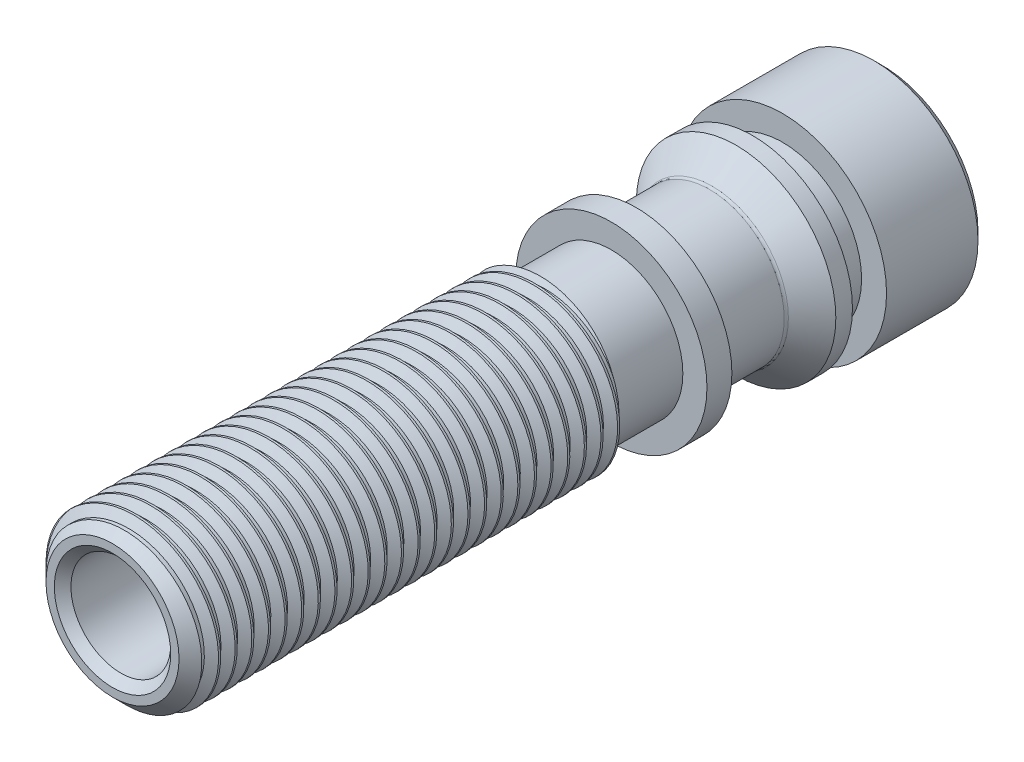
SolidWorks part; units mm, degrees
ref_plane "Front" through (0, 0, 0) normal (0, 0, 1) x (1, 0, 0)
ref_plane "Top" through (0, 0, 0) normal (0, 1, 0) x (1, 0, 0)
ref_plane "Right" through (0, 0, 0) normal (1, 0, 0) x (0, 0, -1)
sketch "Esquisse1" plane through (0, 0, 0) normal (0, 0, 1) x (1, 0, 0)
  circle A0 centre (0, 0) radius 5.75
  dimension "D1" = 11.5
extrude "Boss.-Extru.1" add sketch "Esquisse1" along normal blind 1.5
sketch "Esquisse2" plane through (0, 0, 1.5) normal (0, 0, 1) x (1, 0, 0)
  circle A0 centre (0, 0) radius 4.3
  dimension "D1" = 8.6
extrude "Boss.-Extru.2" add sketch "Esquisse2" along normal blind 4
sketch "Esquisse3" plane through (0, 0, 5.5) normal (0, 0, 1) x (1, 0, 0)
  circle A0 centre (0, 0) radius 5
  dimension "D1" = 10
extrude "Boss.-Extru.3" add sketch "Esquisse3" along normal blind 26
chamfer "Chanfrein1" distance 1 angle 45 1 edges at (5, 0, 31.5)
sketch "Esquisse4" plane through (0, 0, 31.5) normal (0, 0, 1) x (1, 0, 0)
  circle A0 centre (0, 0) radius 3
  dimension "D1" = 6
extrude "Enlèv. mat.-Extru.1" cut sketch "Esquisse4" against normal through all
thread "Filetage1" pitch 1 start angle 0, offset 2, length 0, pitch 1, diameter 10
ref_plane "Plan1" through (-5, 0, 32.5) normal (0, -1, 0) x (-1, 0, 0)
sketch "Profil de filetage1" plane through (-5, 0, 32.5) normal (0, -1, 0) x (-1, 0, 0)
  line L0 (0, 0) -> (0, 1) construction
  line L11 (0, 0) -> (0, 0.875)
  line L12 (0, 0.875) -> (-0.5413, 0.5625)
  line L13 (-0.5413, 0.5625) -> (-0.5413, 0.3125)
  line L15 (-0.5413, 0.3125) -> (0, 0)
  line L17 (-0.5413, 0.4375) -> (0, 0.4375) construction
  point P2 (0, 0)
  dimension "Pitch" = 1
  dimension "Profile_Angle" = 60
  dimension "Profile_Land" = 0.25
  dimension "Profile_Height" = 0.5413
sketch "Esquisse6" plane through (0, 0, 0) normal (1, 0, 0) x (0, 0, -1)
  line L0 (0, 0) -> (23.0549, 0) construction
  line L1 (0, 4.5) -> (4.5, 4.5)
  line L2 (0, -5.75) -> (0, 5.75) construction
  line L3 (12.8, 4.5) -> (12.8, 3)
  line L4 (4.5, 4.5) -> (6, 6)
  line L5 (6, 6) -> (7, 6)
  line L6 (7, 6) -> (7, 4.75)
  line L7 (7, 4.75) -> (8.8, 4.75)
  line L8 (8.8, 4.75) -> (8.8, 6.25)
  line L9 (8.8, 6.25) -> (14.8, 6.25)
  line L10 (14.8, 6.25) -> (14.8, 3)
  line L11 (14.8, 3) -> (12.8, 3)
  line L12 (12.8, 4.5) -> (10.35, 4.5)
  line L13 (10.35, 4.5) -> (10.35, 3)
  line L14 (10.35, 3) -> (0, 3)
  line L15 (0, 3) -> (0, 4.5)
  line L16 (-31.5, 4) -> (-31.5, -4) construction
  point P15 (2.25, 4.5)
  dimension "D1" = 4.5
  dimension "D2" = 4.5
  dimension "D3" = 2.5
  dimension "D4" = 12
  dimension "D5" = 45
  dimension "D6" = 12.5
  dimension "D7" = 1.8
  dimension "D8" = 9.5
  dimension "D9" = 46.3
  dimension "D10" = 6
  dimension "D11" = 2.45
  dimension "D12" = 2
  dimension "D13" = 9
revolve "Révolution1" add sketch "Esquisse6" angle 360 about L0
chamfer "Chanfrein2" distance 0.5 angle 45 3 edges at (6.25, 0, -14.8) (3, 0, -14.8) (3, 0, 31.5)
fillet "Congé1" radius 0.25 2 edges at (4.5, 0, -4.5) (4.5, 0, 0)
